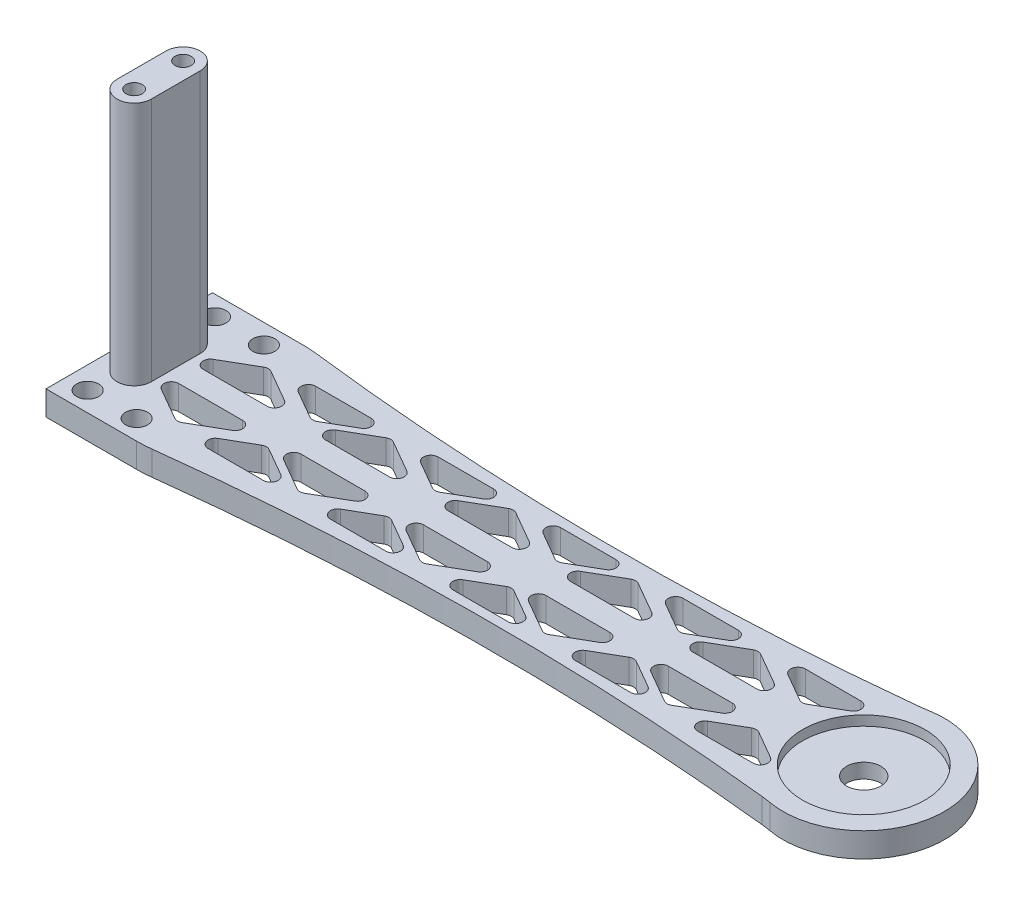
SolidWorks part; units mm, degrees
ref_plane "前视基准面" through (0, 0, 0) normal (0, 0, 1) x (1, 0, 0)
ref_plane "上视基准面" through (0, 0, 0) normal (0, 1, 0) x (1, 0, 0)
ref_plane "右视基准面" through (0, 0, 0) normal (1, 0, 0) x (0, 0, -1)
sketch "草图1" plane through (0, 0, 0) normal (0, 1, 0) x (1, 0, 0)
  line L0 (20, 17) -> (0, 17)
  line L1 (0, -28.047) -> (0, 28.047) construction
  line L2 (0, 17) -> (0, -17)
  line L3 (0, -17) -> (20, -17)
  line L5 (-45.4731, 0) -> (45.4731, 0) construction
  arc A0 (20, 17) -> (146.3579, 16.093) centre (87.1005, 562.8915) ccw
  arc A1 (146.3579, -16.093) -> (146.3579, 16.093) centre (150, 0) ccw
  arc A2 (20, -17) -> (146.3579, -16.093) centre (87.1005, -562.8915) cw
  dimension "D4" = 550
  dimension "D5" = 33
  dimension "D1" = 34
  dimension "D3" = 20
  dimension "D6" = 150
extrude "凸台-拉伸1" add sketch "草图1" along normal mid plane 5 contours A0 A1 A2 L3 L2 L0
sketch "草图2" plane through (0, 2.5, 0) normal (0, 1, 0) x (1, 0, 0)
  circle A0 centre (150, 0) radius 12.5
  dimension "D1" = 25
extrude "切除-拉伸1" cut sketch "草图2" against normal blind 2
sketch "草图3" plane through (0, 0.5, 0) normal (0, 1, 0) x (1, 0, 0)
  circle A0 centre (150, 0) radius 3.5
  dimension "D1" = 7
extrude "切除-拉伸2" cut sketch "草图3" against normal through all
sketch "草图4" plane through (0, 2.5, 0) normal (0, 1, 0) x (1, 0, 0)
  line L0 (12.5981, 2.5) -> (25.6506, 2.5)
  line L1 (26.4006, 5.299) -> (19.8744, 9.067)
  line L2 (18.3744, 9.067) -> (11.8481, 5.299)
  line L3 (-45.4731, 0) -> (45.4731, 0) construction
  line L4 (0, -28.047) -> (0, 28.047) construction
  line L5 (37.5981, 2.5) -> (50.6506, 2.5)
  line L6 (51.4006, 5.299) -> (44.8744, 9.067)
  line L7 (43.3744, 9.067) -> (36.8481, 5.299)
  line L8 (62.5981, 2.5) -> (75.6506, 2.5)
  line L9 (76.4006, 5.299) -> (69.8744, 9.067)
  line L10 (68.3744, 9.067) -> (61.8481, 5.299)
  line L11 (87.5981, 2.5) -> (100.6506, 2.5)
  line L12 (101.4006, 5.299) -> (94.8744, 9.067)
  line L13 (93.3744, 9.067) -> (86.8481, 5.299)
  line L14 (112.5981, 2.5) -> (125.6506, 2.5)
  line L15 (126.4006, 5.299) -> (119.8744, 9.067)
  line L16 (118.3744, 9.067) -> (111.8481, 5.299)
  line L17 (118.3744, -9.067) -> (111.8481, -5.299)
  line L18 (126.4006, -5.299) -> (119.8744, -9.067)
  line L19 (112.5981, -2.5) -> (125.6506, -2.5)
  line L20 (93.3744, -9.067) -> (86.8481, -5.299)
  line L21 (101.4006, -5.299) -> (94.8744, -9.067)
  line L22 (87.5981, -2.5) -> (100.6506, -2.5)
  line L23 (68.3744, -9.067) -> (61.8481, -5.299)
  line L24 (76.4006, -5.299) -> (69.8744, -9.067)
  line L25 (62.5981, -2.5) -> (75.6506, -2.5)
  line L26 (43.3744, -9.067) -> (36.8481, -5.299)
  line L27 (51.4006, -5.299) -> (44.8744, -9.067)
  line L28 (37.5981, -2.5) -> (50.6506, -2.5)
  line L29 (18.3744, -9.067) -> (11.8481, -5.299)
  line L30 (26.4006, -5.299) -> (19.8744, -9.067)
  line L31 (12.5981, -2.5) -> (25.6506, -2.5)
  arc A0 (25.6506, 2.5) -> (26.4006, 5.299) centre (25.6506, 4) ccw
  arc A1 (19.8744, 9.067) -> (18.3744, 9.067) centre (19.1244, 7.7679) ccw
  arc A2 (12.5981, 2.5) -> (11.8481, 5.299) centre (12.5981, 4) cw
  arc A3 (50.6506, 2.5) -> (51.4006, 5.299) centre (50.6506, 4) ccw
  arc A4 (44.8744, 9.067) -> (43.3744, 9.067) centre (44.1244, 7.7679) ccw
  arc A5 (37.5981, 2.5) -> (36.8481, 5.299) centre (37.5981, 4) cw
  arc A6 (75.6506, 2.5) -> (76.4006, 5.299) centre (75.6506, 4) ccw
  arc A7 (69.8744, 9.067) -> (68.3744, 9.067) centre (69.1244, 7.7679) ccw
  arc A8 (62.5981, 2.5) -> (61.8481, 5.299) centre (62.5981, 4) cw
  arc A9 (100.6506, 2.5) -> (101.4006, 5.299) centre (100.6506, 4) ccw
  arc A10 (94.8744, 9.067) -> (93.3744, 9.067) centre (94.1244, 7.7679) ccw
  arc A11 (87.5981, 2.5) -> (86.8481, 5.299) centre (87.5981, 4) cw
  arc A12 (125.6506, 2.5) -> (126.4006, 5.299) centre (125.6506, 4) ccw
  arc A13 (119.8744, 9.067) -> (118.3744, 9.067) centre (119.1244, 7.7679) ccw
  arc A14 (112.5981, 2.5) -> (111.8481, 5.299) centre (112.5981, 4) cw
  arc A15 (112.5981, -2.5) -> (111.8481, -5.299) centre (112.5981, -4) ccw
  arc A16 (119.8744, -9.067) -> (118.3744, -9.067) centre (119.1244, -7.7679) cw
  arc A17 (125.6506, -2.5) -> (126.4006, -5.299) centre (125.6506, -4) cw
  arc A18 (87.5981, -2.5) -> (86.8481, -5.299) centre (87.5981, -4) ccw
  arc A19 (94.8744, -9.067) -> (93.3744, -9.067) centre (94.1244, -7.7679) cw
  arc A20 (100.6506, -2.5) -> (101.4006, -5.299) centre (100.6506, -4) cw
  arc A21 (62.5981, -2.5) -> (61.8481, -5.299) centre (62.5981, -4) ccw
  arc A22 (69.8744, -9.067) -> (68.3744, -9.067) centre (69.1244, -7.7679) cw
  arc A23 (75.6506, -2.5) -> (76.4006, -5.299) centre (75.6506, -4) cw
  arc A24 (37.5981, -2.5) -> (36.8481, -5.299) centre (37.5981, -4) ccw
  arc A25 (44.8744, -9.067) -> (43.3744, -9.067) centre (44.1244, -7.7679) cw
  arc A26 (50.6506, -2.5) -> (51.4006, -5.299) centre (50.6506, -4) cw
  arc A27 (12.5981, -2.5) -> (11.8481, -5.299) centre (12.5981, -4) ccw
  arc A28 (19.8744, -9.067) -> (18.3744, -9.067) centre (19.1244, -7.7679) cw
  arc A29 (25.6506, -2.5) -> (26.4006, -5.299) centre (25.6506, -4) cw
  point P11 (19.1244, 9.5)
  point P14 (7, 2.5)
  point P96 (7, -2.5)
  point P97 (19.1244, -9.5)
  dimension "D6" = 1.5
  dimension "D1" = 30
  dimension "D2" = 150
  dimension "D3" = 2.5
  dimension "D4" = 7
  dimension "D5" = 7
  dimension "D7" = 5
extrude "切除-拉伸3" cut sketch "草图4" against normal through all
sketch "草图5" plane through (0, 2.5, 0) normal (0, 1, 0) x (1, 0, 0)
  line L0 (127.0814, 11) -> (138.4019, 11)
  line L1 (139.1519, 8.201) -> (133.4917, 4.933)
  line L2 (131.9917, 4.933) -> (126.3314, 8.201)
  line L3 (-45.4731, 0) -> (45.4731, 0) construction
  line L4 (102.0814, 11) -> (113.4019, 11)
  line L5 (114.1519, 8.201) -> (108.4917, 4.933)
  line L6 (106.9917, 4.933) -> (101.3314, 8.201)
  line L7 (77.0814, 11) -> (88.4019, 11)
  line L8 (89.1519, 8.201) -> (83.4917, 4.933)
  line L9 (81.9917, 4.933) -> (76.3314, 8.201)
  line L10 (52.0814, 11) -> (63.4019, 11)
  line L11 (64.1519, 8.201) -> (58.4917, 4.933)
  line L12 (56.9917, 4.933) -> (51.3314, 8.201)
  line L13 (27.0814, 11) -> (38.4019, 11)
  line L14 (39.1519, 8.201) -> (33.4917, 4.933)
  line L15 (31.9917, 4.933) -> (26.3314, 8.201)
  line L16 (31.9917, -4.933) -> (26.3314, -8.201)
  line L17 (39.1519, -8.201) -> (33.4917, -4.933)
  line L18 (27.0814, -11) -> (38.4019, -11)
  line L19 (56.9917, -4.933) -> (51.3314, -8.201)
  line L20 (64.1519, -8.201) -> (58.4917, -4.933)
  line L21 (52.0814, -11) -> (63.4019, -11)
  line L22 (81.9917, -4.933) -> (76.3314, -8.201)
  line L23 (89.1519, -8.201) -> (83.4917, -4.933)
  line L24 (77.0814, -11) -> (88.4019, -11)
  line L25 (106.9917, -4.933) -> (101.3314, -8.201)
  line L26 (114.1519, -8.201) -> (108.4917, -4.933)
  line L27 (102.0814, -11) -> (113.4019, -11)
  line L28 (131.9917, -4.933) -> (126.3314, -8.201)
  line L29 (139.1519, -8.201) -> (133.4917, -4.933)
  line L30 (127.0814, -11) -> (138.4019, -11)
  arc A0 (133.4917, 4.933) -> (131.9917, 4.933) centre (132.7417, 6.2321) cw
  arc A1 (138.4019, 11) -> (139.1519, 8.201) centre (138.4019, 9.5) cw
  arc A2 (127.0814, 11) -> (126.3314, 8.201) centre (127.0814, 9.5) ccw
  arc A3 (108.4917, 4.933) -> (106.9917, 4.933) centre (107.7417, 6.2321) cw
  arc A4 (113.4019, 11) -> (114.1519, 8.201) centre (113.4019, 9.5) cw
  arc A5 (102.0814, 11) -> (101.3314, 8.201) centre (102.0814, 9.5) ccw
  arc A6 (83.4917, 4.933) -> (81.9917, 4.933) centre (82.7417, 6.2321) cw
  arc A7 (88.4019, 11) -> (89.1519, 8.201) centre (88.4019, 9.5) cw
  arc A8 (77.0814, 11) -> (76.3314, 8.201) centre (77.0814, 9.5) ccw
  arc A9 (58.4917, 4.933) -> (56.9917, 4.933) centre (57.7417, 6.2321) cw
  arc A10 (63.4019, 11) -> (64.1519, 8.201) centre (63.4019, 9.5) cw
  arc A11 (52.0814, 11) -> (51.3314, 8.201) centre (52.0814, 9.5) ccw
  arc A12 (33.4917, 4.933) -> (31.9917, 4.933) centre (32.7417, 6.2321) cw
  arc A13 (38.4019, 11) -> (39.1519, 8.201) centre (38.4019, 9.5) cw
  arc A14 (27.0814, 11) -> (26.3314, 8.201) centre (27.0814, 9.5) ccw
  arc A15 (27.0814, -11) -> (26.3314, -8.201) centre (27.0814, -9.5) cw
  arc A16 (38.4019, -11) -> (39.1519, -8.201) centre (38.4019, -9.5) ccw
  arc A17 (33.4917, -4.933) -> (31.9917, -4.933) centre (32.7417, -6.2321) ccw
  arc A18 (52.0814, -11) -> (51.3314, -8.201) centre (52.0814, -9.5) cw
  arc A19 (63.4019, -11) -> (64.1519, -8.201) centre (63.4019, -9.5) ccw
  arc A20 (58.4917, -4.933) -> (56.9917, -4.933) centre (57.7417, -6.2321) ccw
  arc A21 (77.0814, -11) -> (76.3314, -8.201) centre (77.0814, -9.5) cw
  arc A22 (88.4019, -11) -> (89.1519, -8.201) centre (88.4019, -9.5) ccw
  arc A23 (83.4917, -4.933) -> (81.9917, -4.933) centre (82.7417, -6.2321) ccw
  arc A24 (102.0814, -11) -> (101.3314, -8.201) centre (102.0814, -9.5) cw
  arc A25 (113.4019, -11) -> (114.1519, -8.201) centre (113.4019, -9.5) ccw
  arc A26 (108.4917, -4.933) -> (106.9917, -4.933) centre (107.7417, -6.2321) ccw
  arc A27 (127.0814, -11) -> (126.3314, -8.201) centre (127.0814, -9.5) cw
  arc A28 (138.4019, -11) -> (139.1519, -8.201) centre (138.4019, -9.5) ccw
  arc A29 (133.4917, -4.933) -> (131.9917, -4.933) centre (132.7417, -6.2321) ccw
  point P5 (150, 0)
  point P9 (132.7417, 4.5)
  point P12 (144, 11)
  point P96 (144, -11)
  point P97 (132.7417, -4.5)
  dimension "D6" = 1.5
  dimension "D1" = 6.5
  dimension "D2" = 11
  dimension "D3" = 6
  dimension "D4" = 30
  dimension "D5" = 30
  dimension "D7" = 5
extrude "切除-拉伸4" cut sketch "草图5" against normal through all
sketch "草图6" plane through (0, 2.5, 0) normal (0, 1, 0) x (1, 0, 0)
  line L0 (0, -28.047) -> (0, 28.047) construction
  line L1 (-45.4731, 0) -> (45.4731, 0) construction
  circle A0 centre (4.5, 13) radius 2.25
  circle A1 centre (14.5, 13) radius 2.25
  dimension "D1" = 4.5
  dimension "D4" = 4.5
  dimension "D2" = 10
  dimension "D3" = 4.5
  dimension "D5" = 13
extrude "切除-拉伸5" cut sketch "草图6" against normal through all
mirror "镜向1" about plane through (0, 0, 0) normal (0, 0, 1) of "切除-拉伸5"
fillet "圆角1" radius 25 4 edges at (20, 0, 17) (146.3579, 0, 16.093) (146.3579, 0, -16.093) (20, 0, -17)
sketch "草图8" plane through (0, 2.5, 0) normal (0, 1, 0) x (1, 0, 0)
  line L0 (6, 5) -> (6, -5) construction
  line L1 (9.5, 5) -> (9.5, -5)
  line L2 (2.5, 5) -> (2.5, -5)
  line L3 (-45.4731, 0) -> (45.4731, 0) construction
  line L4 (0, -28.047) -> (0, 28.047) construction
  arc A0 (9.5, 5) -> (2.5, 5) centre (6, 5) ccw
  arc A1 (2.5, -5) -> (9.5, -5) centre (6, -5) ccw
  point P2 (6, 0)
  point P10 (6, 8.5)
  dimension "D1" = 8.5
  dimension "D2" = 7
  dimension "D3" = 6
extrude "凸台-拉伸2" add sketch "草图8" along normal blind 50
sketch "草图9" plane through (0, 52.5, 0) normal (0, 1, 0) x (1, 0, 0)
  arc A0 (2.5, -5) -> (9.5, -5) centre (6, -5) ccw construction
  arc A1 (9.5, 5) -> (2.5, 5) centre (6, 5) ccw construction
  point P0 (6, 5)
  point P1 (6, -5)
hole_wizard "M4 螺纹孔1" positions "3D草图2" profile "草图10" tap size "M4" standard "ISO"
sketch3d "3D草图2"
  point P0 (6, 52.5, -5)
  point P3 (6, 52.5, 5)
sketch "草图10" plane through (6, 52.5, -5) normal (1, 0, 0) x (0, 0, 1)
  line L0 (0, 0) -> (0, 12.4914)
  line L1 (0, 12.4914) -> (1.65, 11.5)
  line L2 (1.65, 11.5) -> (1.65, 0)
  line L5 (1.65, 0) -> (0, 0)
  line L10 (0, 12.4914) -> (-1.65, 11.5) construction
  line L11 (0, -6.35) -> (0, 107.95) construction
  dimension "螺纹孔钻头直径" = 3.3
  dimension "螺纹孔钻头深度" = 11.5
  dimension "导头角度" = 118
